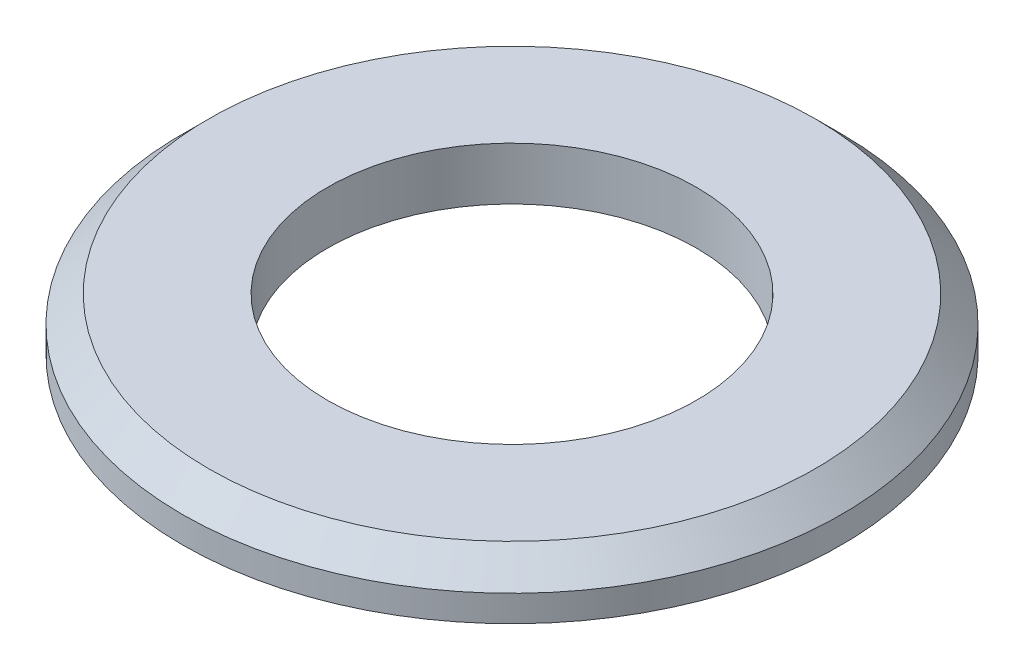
SolidWorks part; units mm, degrees
ref_plane "Front" through (0, 0, 0) normal (0, 0, 1) x (1, 0, 0)
ref_plane "Top" through (0, 0, 0) normal (0, 1, 0) x (1, 0, 0)
ref_plane "Right" through (0, 0, 0) normal (1, 0, 0) x (0, 0, -1)
sketch "Sketch1" plane through (0, 0, 0) normal (0, 1, 0) x (1, 0, 0)
  circle A0 centre (0, 0) radius 14
  circle A1 centre (0, 0) radius 25
extrude "Extrude1" add sketch "Sketch1" along normal blind 4
chamfer "Chamfer1" distance 2 1 edges at (0, 4, 25)
